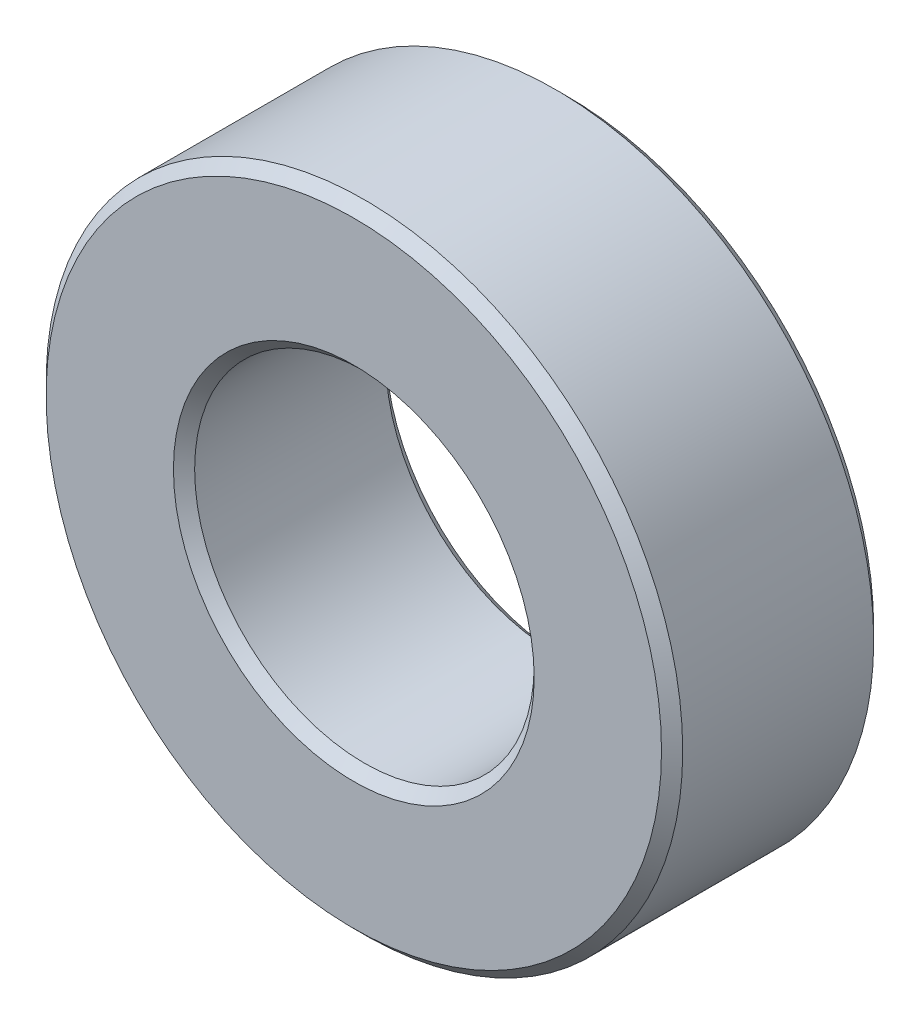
SolidWorks part; units mm, degrees
ref_plane "Front Plane" through (0, 0, 0) normal (0, 0, 1) x (1, 0, 0)
ref_plane "Top Plane" through (0, 0, 0) normal (0, 1, 0) x (1, 0, 0)
ref_plane "Right Plane" through (0, 0, 0) normal (1, 0, 0) x (0, 0, -1)
sketch "Sketch1" plane through (0, 0, 0) normal (0, 0, 1) x (1, 0, 0)
  circle A0 centre (0, 0) radius 3
  circle A1 centre (0, 0) radius 1.6
  dimension "D1" = 6
  dimension "D2" = 3.2
extrude "Boss-Extrude2" add sketch "Sketch1" along normal mid plane 2
chamfer "Chamfer3" distance 0.1 angle 45 4 edges at (3, 0, 1) (3, 0, -1) (1.6, 0, -1) (1.6, 0, 1)
